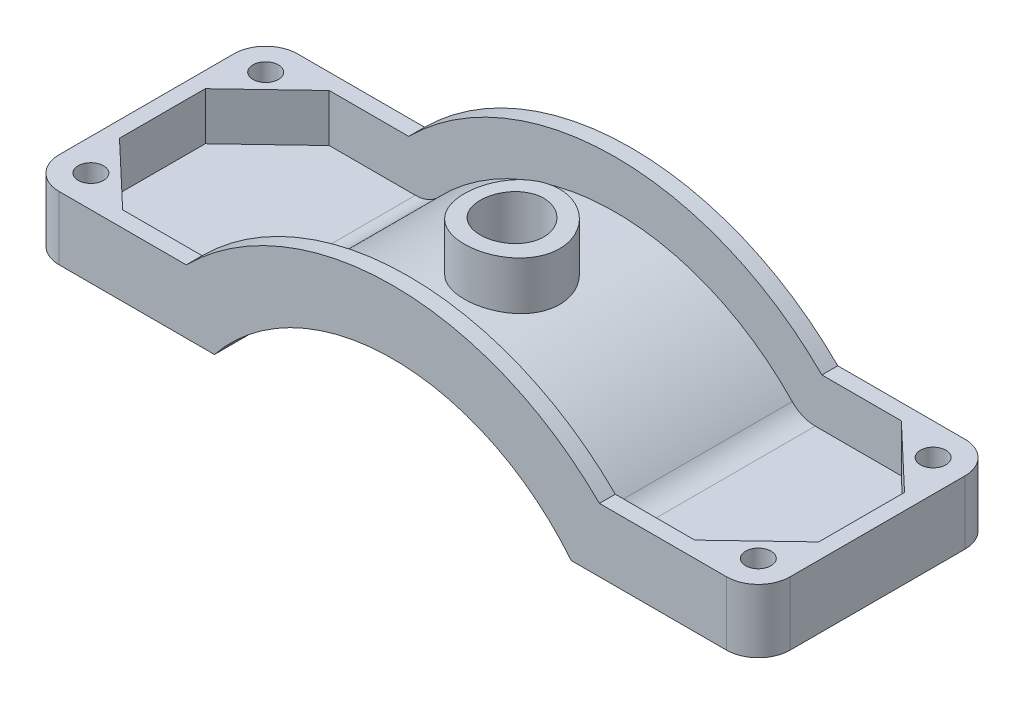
SolidWorks part; units mm, degrees
ref_plane "Front Plane" through (0, 0, 0) normal (0, 0, 1) x (1, 0, 0)
ref_plane "Top Plane" through (0, 0, 0) normal (0, 1, 0) x (1, 0, 0)
ref_plane "Right Plane" through (0, 0, 0) normal (1, 0, 0) x (0, 0, -1)
sketch "Sketch1" plane through (0, 0, 0) normal (0, 0, 1) x (1, 0, 0)
  line L0 (0, 0) -> (50, 0)
  line L4 (180, 0) -> (230, 0)
  arc A0 (50, 0) -> (180, 0) centre (115, -65.1076) cw
  dimension "D3" = 92
  dimension "D1" = 50
  dimension "D2" = 130
extrude "Extrude-Thin1" add sketch "Sketch1" along normal mid plane 75 thin
sketch "Sketch7" plane through (0, 0, 0) normal (0, -1, 0) x (1, 0, 0)
  line L1 (171.1187, 37.5) -> (58.8813, 37.5) construction
  circle A0 centre (115, 0) radius 10
  point P5 (115, 37.5)
  dimension "D1" = 20
extrude "Cut-Extrude4" cut sketch "Sketch7" against normal through all
shell "Shell1" thickness 5
ref_plane "Plane1" through (115, 0, 0) normal (-1, 0, 0) x (0, 0, 1)
fillet "Fillet1" radius 10 4 edges at (230, -10, -37.5) (0, -10, -37.5) (230, -10, 37.5) (0, -10, 37.5)
fillet "Fillet2" radius 10 2 edges at (173.4656, -15, 0) (56.5344, -15, 0)
sketch "Sketch9" plane through (0, -15, 0) normal (0, 1, 0) x (1, 0, 0)
  line L0 (25, 32.5) -> (5, 13.5)
  line L1 (5, 32.5) -> (52.1027, 32.5) construction
  line L2 (5, -32.5) -> (5, 32.5) construction
  line L3 (5, 13.5) -> (5, 32.5)
  line L4 (5, 32.5) -> (25, 32.5)
  dimension "D1" = 19
  dimension "D2" = 20
extrude "Boss-Extrude5" add sketch "Sketch9" along normal up to surface (15 mm away)
sketch "Sketch5" plane through (0, 0, 0) normal (0, 1, 0) x (1, 0, 0)
  circle A0 centre (10, 27.5) radius 4
  dimension "D1" = 8
extrude "Cut-Extrude2" cut sketch "Sketch5" against normal through all
mirror "Mirror2" about plane through (0, 0, 0) normal (0, 0, 1) of "Boss-Extrude5", "Cut-Extrude2"
mirror "Mirror3" about plane through (115, 0, 0) normal (-1, 0, 0) of "Mirror2", "Boss-Extrude5", "Cut-Extrude2"
